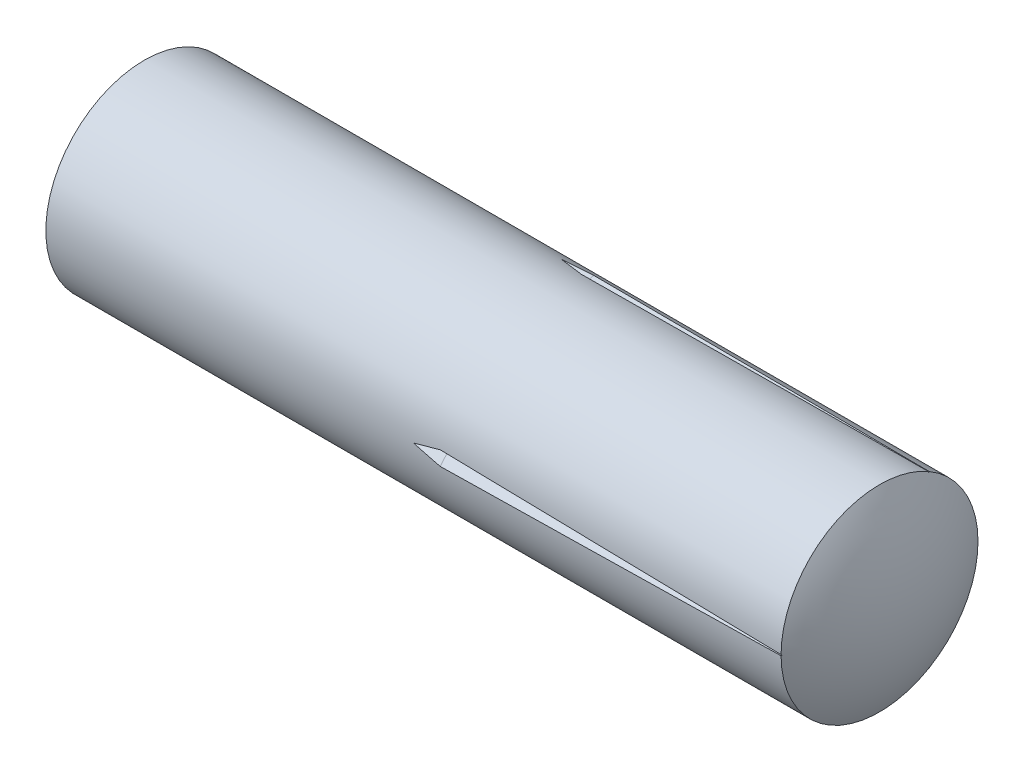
SolidWorks part; units mm, degrees
ref_plane "Plane1" through (0, 0, 0) normal (0, 0, 1) x (1, 0, 0)
ref_plane "Plane2" through (0, 0, 0) normal (0, 1, 0) x (1, 0, 0)
ref_plane "Plane3" through (0, 0, 0) normal (1, 0, 0) x (0, 0, -1)
sketch "Sketch1" plane through (0, 0, 0) normal (0, 0, 1) x (1, 0, 0)
  line L0 (-57, 0) -> (60, 0) construction
  line L1 (-50, 0) -> (-50, 1.25)
  line L2 (-46.6819, 12.5) -> (46.6506, 12.5)
  line L3 (-50, 0) -> (50, 0)
  arc A0 (-46.6819, 12.5) -> (-50, 1.25) centre (-25.0313, 0) ccw
  arc A1 (50, 0) -> (46.6506, 12.5) centre (25, 0) ccw
  dimension "D1" = 25
  dimension "D2" = 25
  dimension "Diameter" = 25
  dimension "D3" = 2.5
  dimension "Length" = 100
revolve "Base-Revolve" add sketch "Sketch1" angle 360 about L0
sketch "Sketch2" plane through (0, 0, 0) normal (1, 0, 0) x (0, 0, -1)
  line L0 (0, 0) -> (-14, 0) construction
  line L1 (-12.5, 0) -> (-14.3784, 1.3152)
  line L2 (-12.5, 0) -> (-14.3784, -1.3152)
  line L3 (-14.3784, -1.3152) -> (-14.3784, 1.3152)
  circle A0 centre (0, 0) radius 12.5 construction
  dimension "D1" = 25
  dimension "D2" = 70
  dimension "D3" = 35
  dimension "D4" = 1.8784
sketch "Sketch3" plane through (0, 0, 0) normal (0, 1, 0) x (1, 0, 0)
  line L0 (0, 0) -> (50, 0) construction
  line L1 (-57, 0) -> (60, 0) construction
  line L2 (0, -12.5) -> (3.125, -11.25)
  line L3 (3.125, -11.25) -> (50, -12.5)
  dimension "D1" = 50
  dimension "D2" = 25
  dimension "D3" = 22.5
  dimension "D4" = 25
  dimension "D5" = 3.125
sweep "Cut-Sweep1" cut profiles "Sketch2" path "Sketch3"
pattern_circular "CirPattern1" count 3 over 360 about axis through (0, 0, 0) along (1, 0, 0) of "Cut-Sweep1"
equation "\"D1@Sketch1\" = \"Diameter@Sketch1\""
equation "\"D2@Sketch1\" = \"Diameter@Sketch1\""
equation "\"D3@Sketch1\" = \"Diameter@Sketch1\" * .1"
equation "\"D1@Sketch2\" = \"Diameter@Sketch1\""
equation "\"D3@Sketch2\" = \"D2@Sketch2\" / 2"
equation "\"D1@Sketch3\" = \"Length@Sketch1\" / 2"
equation "\"D2@Sketch3\" = \"Diameter@Sketch1\""
equation "\"D3@Sketch3\" = \"Diameter@Sketch1\" * .9"
equation "\"D4@Sketch3\" = \"Diameter@Sketch1\""
equation "\"D5@Sketch3\" = \"D1@Sketch1\" / 8"
